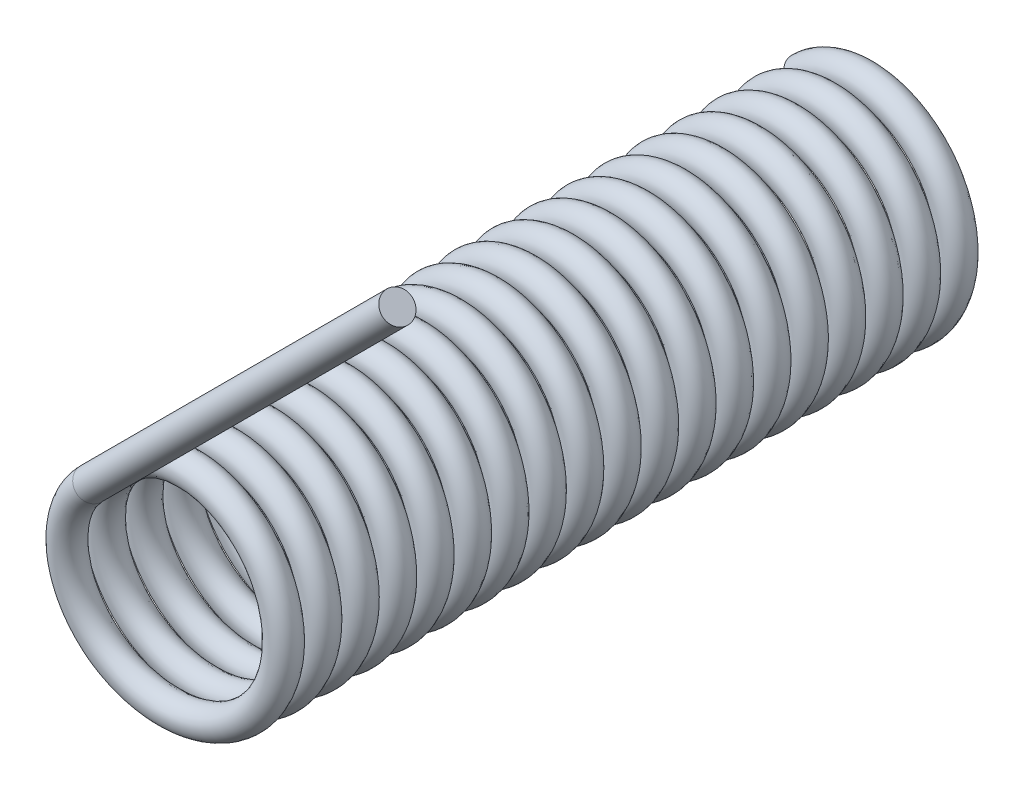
SolidWorks part; units mm, degrees
ref_plane "Front Plane" through (0, 0, 0) normal (0, 0, 1) x (1, 0, 0)
ref_plane "Top Plane" through (0, 0, 0) normal (0, 1, 0) x (1, 0, 0)
ref_plane "Right Plane" through (0, 0, 0) normal (1, 0, 0) x (0, 0, -1)
sketch "Sketch1" plane through (0, 0, 0) normal (0, 0, 1) x (1, 0, 0)
  circle A0 centre (-35.574, 18.1128) radius 3.9687
  dimension "D1" = 7.9375
curve "Helix/Spiral1"
ref_plane "Plane1" through (-38.3804, 20.9191, 28.575) normal (0.7058, 0.7058, 0.0602) x (0.0426, 0.0426, -0.9982)
sketch "Sketch3" plane through (-38.3804, 20.9191, 28.575) normal (0.7058, 0.7058, 0.0602) x (0.0426, 0.0426, -0.9982)
  circle A0 centre (-0.0001, -0.0001) radius 0.5953
  dimension "D1" = 1.1906
sweep "Sweep2" add profiles "Sketch3" path "Helix/Spiral1"
sketch "Sketch4" plane through (-7.4848, -7.4848, -0.6384) normal (0.7058, 0.7058, 0.0602) x (0.0426, 0.0426, -0.9982)
  circle A0 centre (-29.2666, 41.931) radius 0.5953
extrude "Extrude1" add sketch "Sketch4" along normal blind 19.05
sketch "Sketch5" plane through (-8.699, -8.699, -0.742) normal (-0.7058, -0.7058, -0.0602) x (-0.0426, -0.0426, 0.9982)
  circle A0 centre (0.7434, 41.931) radius 0.5953
